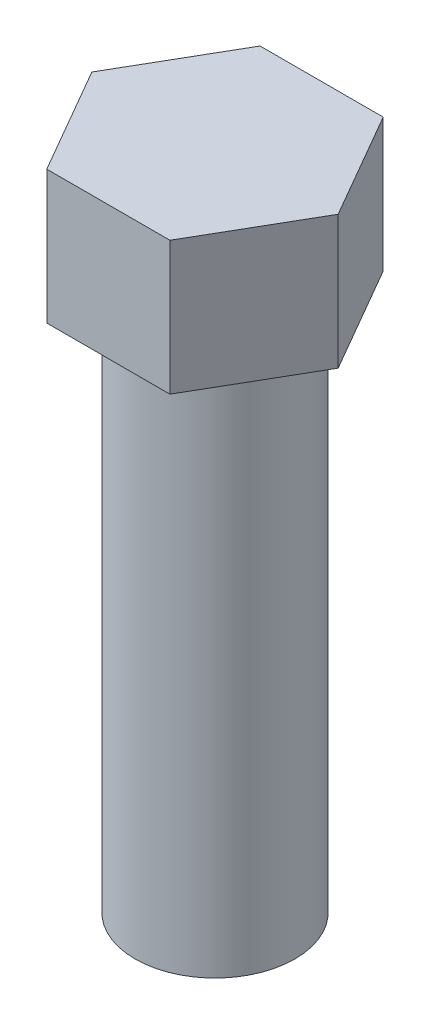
SolidWorks part; units mm, degrees
ref_plane "Front Plane" through (0, 0, 0) normal (0, 0, 1) x (1, 0, 0)
ref_plane "Top Plane" through (0, 0, 0) normal (0, 1, 0) x (1, 0, 0)
ref_plane "Right Plane" through (0, 0, 0) normal (1, 0, 0) x (0, 0, -1)
sketch "Sketch1" plane through (0, 0, 0) normal (0, 1, 0) x (1, 0, 0)
  circle A0 centre (0, 0) radius 6
  dimension "D1" = 12
extrude "Boss-Extrude1" add sketch "Sketch1" along normal blind 40
sketch "Sketch2" plane through (0, 40, 0) normal (0, 1, 0) x (1, 0, 0)
  line L1 (9.2376, 0) -> (4.6188, 8)
  line L2 (4.6188, 8) -> (-4.6188, 8)
  line L3 (-4.6188, 8) -> (-9.2376, 0)
  line L4 (-9.2376, 0) -> (-4.6188, -8)
  line L5 (-4.6188, -8) -> (4.6188, -8)
  line L6 (4.6188, -8) -> (9.2376, 0)
  circle A0 centre (0, 0) radius 8 construction
  dimension "D1" = 16
extrude "Boss-Extrude2" add sketch "Sketch2" along normal blind 10
